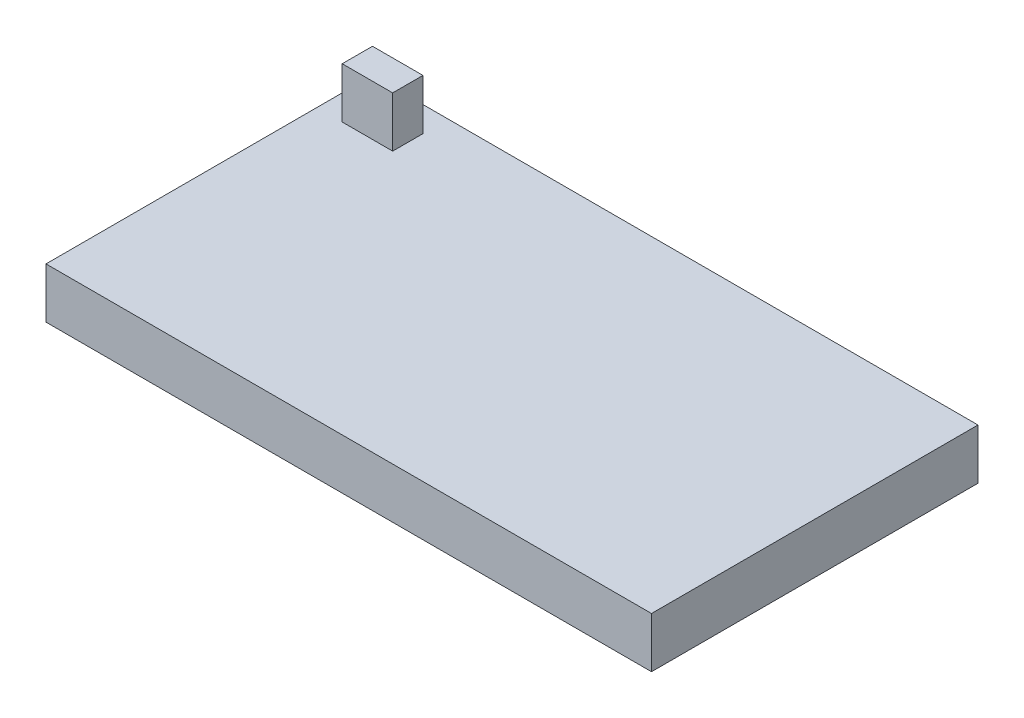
SolidWorks part; units mm, degrees
ref_plane "Front Plane" through (0, 0, 0) normal (0, 0, 1) x (1, 0, 0)
ref_plane "Top Plane" through (0, 0, 0) normal (0, 1, 0) x (1, 0, 0)
ref_plane "Right Plane" through (0, 0, 0) normal (1, 0, 0) x (0, 0, -1)
sketch "Sketch1" plane through (0, 0, 0) normal (0, 1, 0) x (1, 0, 0)
  line L1 (-76.2, 38.1) -> (76.2, 38.1)
  line L2 (-76.2, 38.1) -> (-76.2, -44.0729)
  line L3 (-76.2, -44.0729) -> (76.2, -44.0729)
  line L4 (76.2, 38.1) -> (76.2, -44.0729)
  dimension "D1" = 152.4
  dimension "D2" = 76.2
  dimension "D3" = 82.1729
  dimension "D4" = 44.0729
extrude "Extrude1" add sketch "Sketch1" along normal blind 12.7
sketch "Sketch2" plane through (0, 12.7, 0) normal (0, 1, 0) x (1, 0, 0)
  line L0 (-76.2, 38.1) -> (-76.2, -44.0729) construction
  line L1 (-69.85, 31.75) -> (-57.15, 31.75)
  line L2 (-69.85, 31.75) -> (-69.85, 24.13)
  line L3 (-69.85, 24.13) -> (-57.15, 24.13)
  line L4 (-57.15, 31.75) -> (-57.15, 24.13)
  line L5 (76.2, 38.1) -> (-76.2, 38.1) construction
  dimension "D1" = 12.7
  dimension "D2" = 7.62
  dimension "D3" = 6.35
  dimension "D4" = 6.35
extrude "Extrude2" add sketch "Sketch2" along normal blind 12.7
